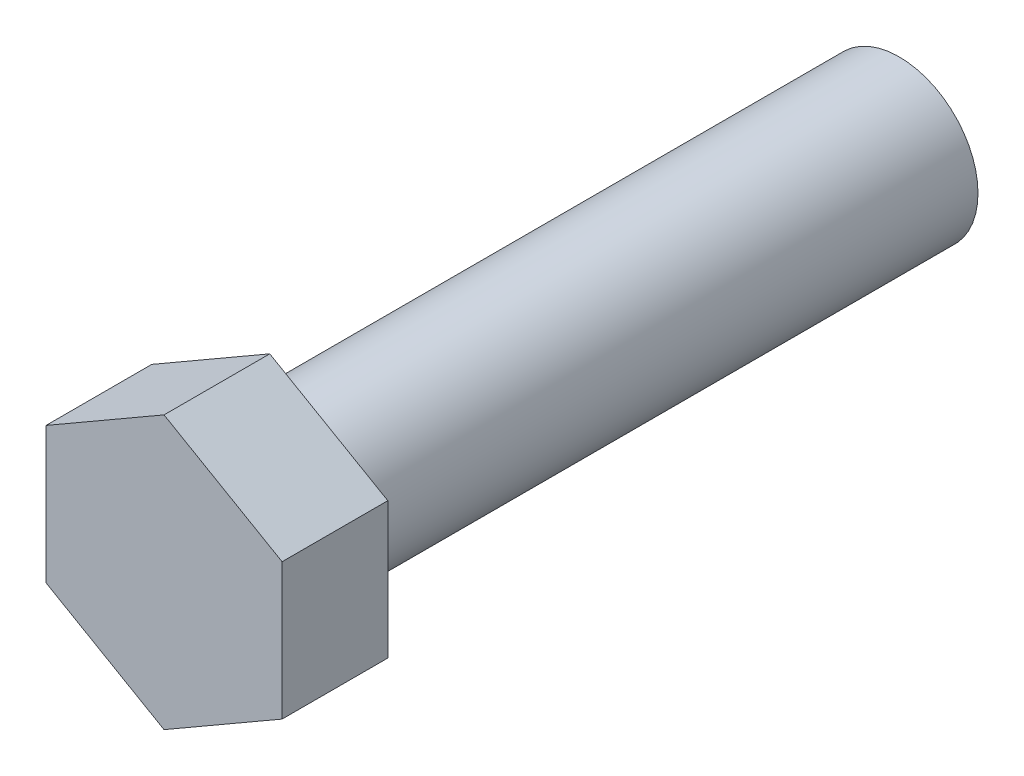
SolidWorks part; units mm, degrees
ref_plane "Front Plane" through (0, 0, 0) normal (1, 0, 0) x (0, 1, 0)
ref_plane "Top Plane" through (0, 0, 0) normal (0, 0, 1) x (0, 1, 0)
ref_plane "Right Plane" through (0, 0, 0) normal (0, 1, 0) x (-1, 0, 0)
sketch "Sketch1"
sketch_block_instance "W14x730-1-1"
sketch_block "W14x730-1" parameters "D4"=15.24, "D1"=454.406, "D2"=569.468, "D3"=77.978, "D5"=124.714
sketch "sk body" plane through (0, 0, 0) normal (0, 0, 1) x (0, 1, 0)
  circle A0 centre (0, 0) radius 50.8
  dimension "D1" = 101.6
sketch "sk Max dia" plane through (0, 0, 0) normal (0, 0, 1) x (0, 1, 0)
  circle A0 centre (0, 0) radius 52.2097
  dimension "D1" = 104.4194
sketch "Sketch3" plane through (0, 0, 0) normal (0, 0, 1) x (0, 1, 0)
  line L1 (87.9882, 0) -> (43.9941, 76.2)
  line L2 (43.9941, 76.2) -> (-43.9941, 76.2)
  line L3 (-43.9941, 76.2) -> (-87.9882, 0)
  line L4 (-87.9882, 0) -> (-43.9941, -76.2)
  line L5 (-43.9941, -76.2) -> (43.9941, -76.2)
  line L6 (43.9941, -76.2) -> (87.9882, 0)
  circle A0 centre (0, 0) radius 76.2 construction
  dimension "D1" = 152.4
extrude "bolt Head" add sketch "Sketch3" along normal blind 68.2625
extrude "bolt Body" add sketch "sk body" against normal blind 406.4
